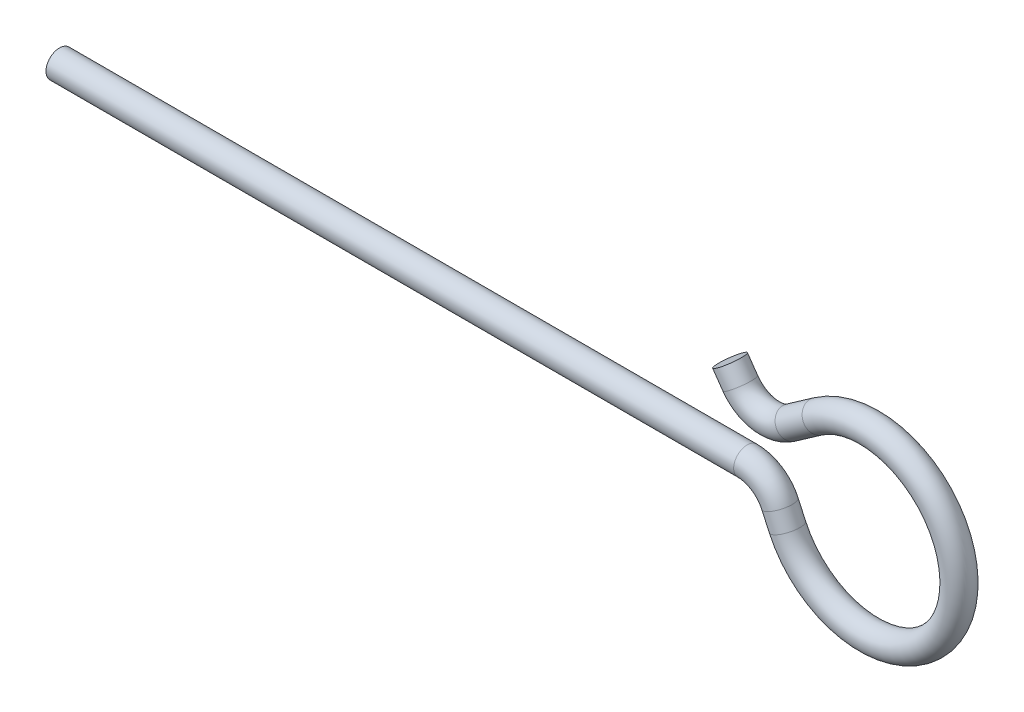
SolidWorks part; units mm, degrees
ref_plane "Plan1" through (0, 0, 0) normal (0, 0, 1) x (1, 0, 0)
ref_plane "Plan2" through (0, 0, 0) normal (0, 1, 0) x (1, 0, 0)
ref_plane "Plan3" through (0, 0, 0) normal (1, 0, 0) x (0, 0, -1)
sketch "Esquisse1" plane through (0, 0, 0) normal (0, 0, 1) x (1, 0, 0)
  line L0 (0, 0) -> (38.2177, 0)
  line L1 (40.4524, -2.0782) -> (40.0367, -1.1687)
  line L2 (42.1319, 4.0956) -> (40.6319, 3.0452)
  line L3 (37.8464, 3.5362) -> (37.2728, 4.3553)
  arc A0 (42.1319, 4.0956) -> (40.4524, -2.0782) centre (45, 0) cw
  arc A1 (40.0367, -1.1687) -> (38.2177, 0) centre (38.2177, -2) ccw
  arc A2 (40.6319, 3.0452) -> (37.8464, 3.5362) centre (39.4847, 4.6835) cw
  dimension "D1" = 2
  dimension "D2" = 5
  dimension "D5" = 2
  dimension "D3" = 45
  dimension "D4" = 1
  dimension "D6" = 1.5
  dimension "D7" = 1
  dimension "D8" = 90
sketch "Esquisse2" plane through (0, 0, 0) normal (1, 0, 0) x (0, 0, -1)
  circle A0 centre (0.0051, 0.0083) radius 0.75
  dimension "D1" = 1.5
sweep "Balayage1" add profiles "Esquisse2" path "Esquisse1"
